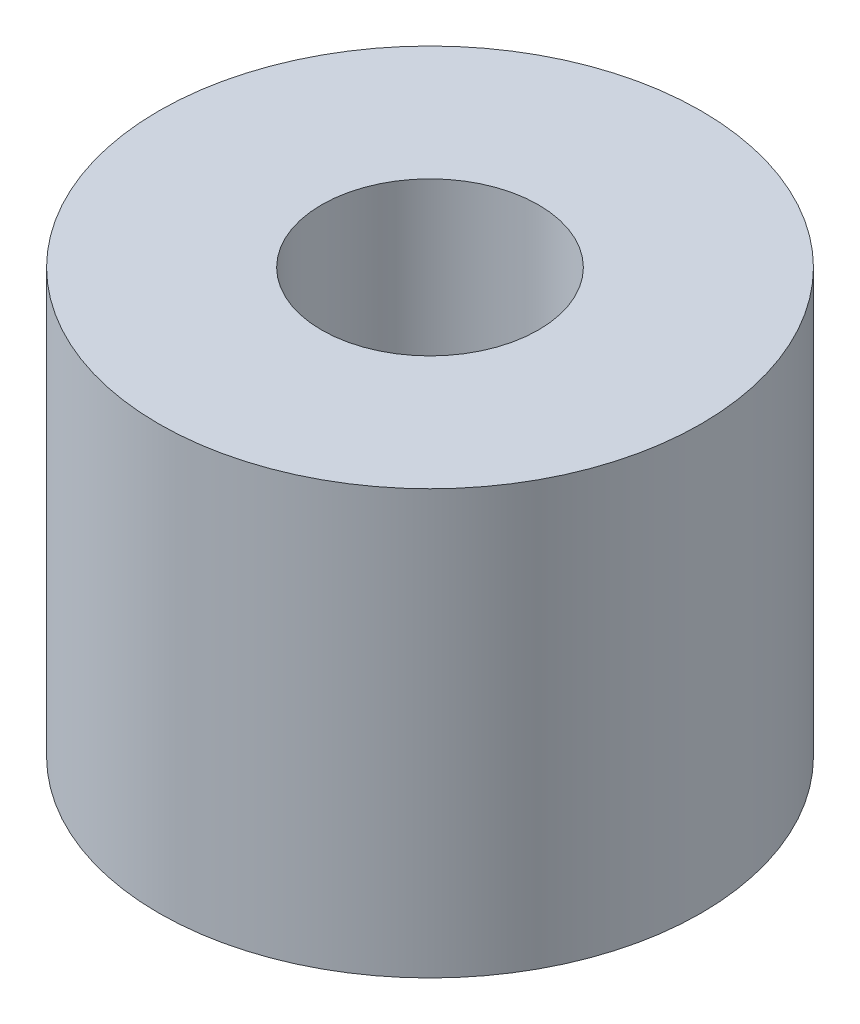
SolidWorks part; units mm, degrees
ref_plane "前视基准面" through (0, 0, 0) normal (0, 0, 1) x (1, 0, 0)
ref_plane "上视基准面" through (0, 0, 0) normal (0, 1, 0) x (1, 0, 0)
ref_plane "右视基准面" through (0, 0, 0) normal (1, 0, 0) x (0, 0, -1)
other "Configuration Table"
sketch "草图1" plane through (0, 0, 0) normal (0, 1, 0) x (1, 0, 0)
  circle A0 centre (0, 0) radius 1.6
  circle A1 centre (0, 0) radius 4
  dimension "D1" = 3.2
  dimension "D2" = 8
extrude "凸台-拉伸1" add sketch "草图1" along normal blind 6.25
